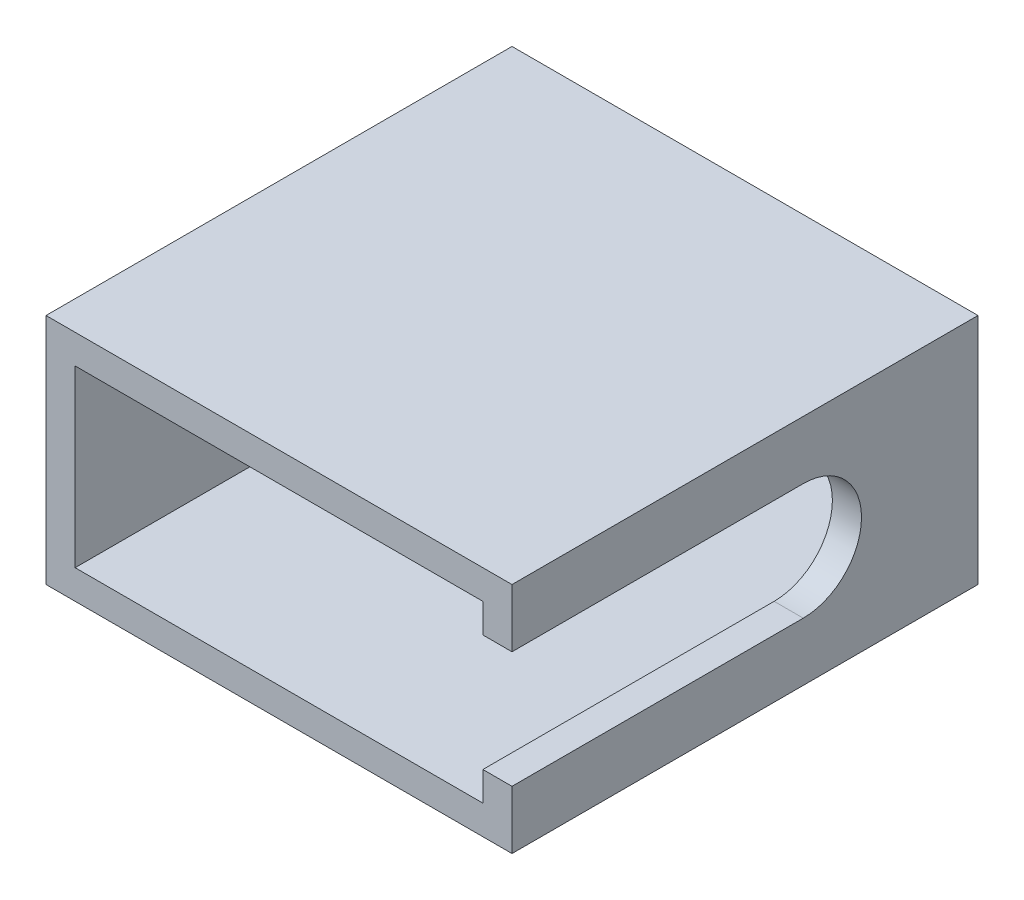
SolidWorks part; units mm, degrees
ref_plane "Front Plane" through (0, 0, 0) normal (0, 0, 1) x (1, 0, 0)
ref_plane "Top Plane" through (0, 0, 0) normal (0, 1, 0) x (1, 0, 0)
ref_plane "Right Plane" through (0, 0, 0) normal (1, 0, 0) x (0, 0, -1)
ref_plane "Plane1" through (0, 0, 50.8) normal (0, 0, 1) x (1, 0, 0)
sketch "Sketch1" plane through (0, 0, 50.8) normal (0, 0, 1) x (1, 0, 0)
  line L0 (25.4, -12.7) -> (25.4, 12.7)
  line L1 (25.4, 12.7) -> (-25.4, 12.7)
  line L2 (-25.4, 12.7) -> (-25.4, -12.7)
  line L3 (-25.4, -12.7) -> (25.4, -12.7)
  line L4 (-22.225, 9.525) -> (22.225, 9.525)
  line L5 (22.225, 9.525) -> (22.225, -9.525)
  line L6 (22.225, -9.525) -> (-22.225, -9.525)
  line L7 (-22.225, -9.525) -> (-22.225, 9.525)
extrude "Boss-Extrude1" add sketch "Sketch1" against normal blind 50.8
sketch "Sketch2" plane through (22.225, 0, 0) normal (-1, 0, 0) x (0, 0, 1)
  line L0 (50.8, -6.35) -> (50.8, 6.35)
  line L1 (50.8, 6.35) -> (19.05, 6.35)
  line L2 (19.05, -6.35) -> (50.8, -6.35)
  arc A0 (19.05, 6.35) -> (19.05, -6.35) centre (19.05, 0) ccw
extrude "Cut-Extrude1" cut sketch "Sketch2" against normal through all
